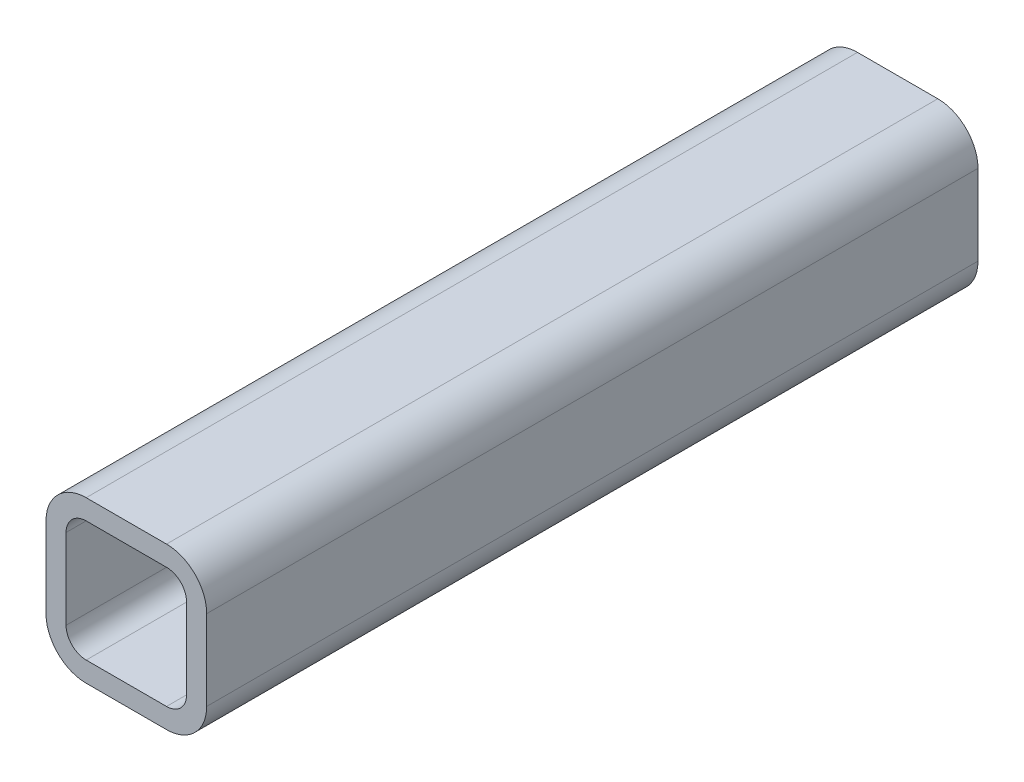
SolidWorks part; units mm, degrees
ref_plane "Front Plane" through (0, 0, 0) normal (0, 0, 1) x (1, 0, 0)
ref_plane "Top Plane" through (0, 0, 0) normal (0, 1, 0) x (1, 0, 0)
ref_plane "Right Plane" through (0, 0, 0) normal (1, 0, 0) x (0, 0, -1)
sketch "Sketch1" plane through (0, 0, 0) normal (0, 0, 1) x (1, 0, 0)
sketch_block_instance "HSS2.5x2.5x0.3125-1"
sketch_block "HSS2.5x2.5x0.3125"
extrude "Boss-Extrude1" add sketch "Sketch1" along normal blind 304.8
